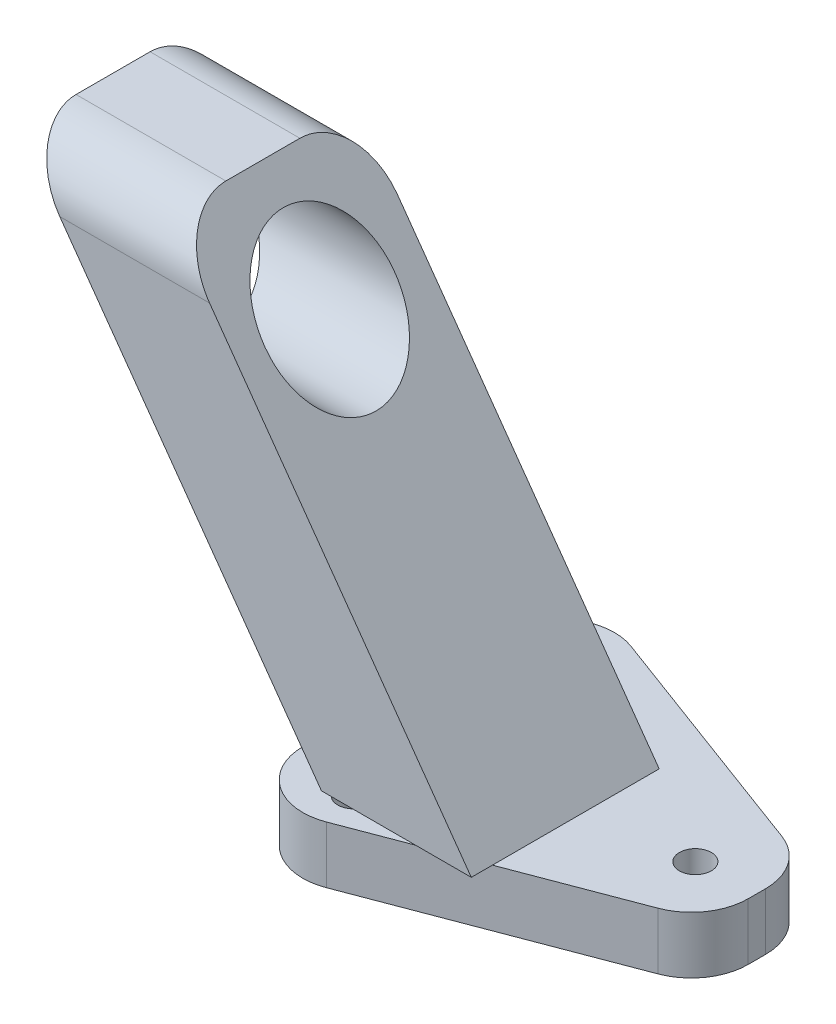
SolidWorks part; units mm, degrees
ref_plane "前视基准面" through (0, 0, 0) normal (0, 0, 1) x (1, 0, 0)
ref_plane "上视基准面" through (0, 0, 0) normal (0, 1, 0) x (1, 0, 0)
ref_plane "右视基准面" through (0, 0, 0) normal (1, 0, 0) x (0, 0, -1)
sketch "草图1" plane through (0, 0, 0) normal (0, 1, 0) x (1, 0, 0)
  line L0 (-6.9131, 24.5945) -> (14.2, 16.7547)
  line L2 (-13.6536, 19.9072) -> (-13.6536, 2.5307)
  line L5 (17.4595, 12.0675) -> (17.4595, 10.534)
  line L6 (14.2318, 5.8587) -> (-6.8813, -2.1447)
  circle A0 centre (-7.68, 21.0315) radius 1.3961
  circle A1 centre (-7.68, 1.0315) radius 1.3964
  circle A2 centre (12.32, 11.0315) radius 1.4013
  arc A3 (-13.6536, 19.9072) -> (-6.9131, 24.5945) centre (-8.6536, 19.9072) cw
  arc A4 (17.4595, 10.534) -> (14.2318, 5.8587) centre (12.4595, 10.534) cw
  arc A5 (14.2, 16.7547) -> (17.4595, 12.0675) centre (12.4595, 12.0675) cw
  arc A6 (-6.8813, -2.1447) -> (-13.6536, 2.5307) centre (-8.6536, 2.5307) cw
  dimension "D1" = 5
  dimension "D2" = 5
extrude "凸台-拉伸1" add sketch "草图1" along normal blind 5
sketch "草图2" plane through (0, 0, 0) normal (0, 0, 1) x (1, 0, 0)
  line L0 (3.6753, 5) -> (-22.9469, 42.2804)
  line L1 (-6.8813, 5) -> (14.2318, 5) construction
  line L2 (-22.9469, 42.2804) -> (-36.1015, 42.2804)
  line L3 (-36.1015, 42.2804) -> (-9.4793, 5)
  line L4 (-6.8813, 5) -> (-13.6536, 5) construction
  line L5 (-9.4793, 5) -> (3.6753, 5)
extrude "凸台-拉伸2" add sketch "草图2" against normal blind 16.5
sketch "草图3" plane through (0, 0, 0) normal (0, 0, 1) x (1, 0, 0)
  line L0 (-36.1015, 42.2804) -> (-22.9469, 42.2804)
  line L1 (-22.9469, 42.2804) -> (3.6753, 5)
  line L2 (3.6753, 5) -> (-9.4793, 5)
  line L3 (-9.4793, 5) -> (-36.1015, 42.2804)
sketch "草图4" plane through (130.3294, 15.9383, 2.8459) normal (1, 0, 0) x (0, -1, 0)
  circle A0 centre (-17.8903, 11) radius 5.7
extrude "切除-拉伸2" cut sketch "草图4" against normal blind 179
sketch "草图5" plane through (0, 42.2804, 0) normal (0, 1, 0) x (1, 0, 0)
  line L1 (-38.8482, 19.6052) -> (-19.2437, 19.6052)
  line L2 (-38.8482, 19.6052) -> (-38.8482, -2.4539)
  line L3 (-38.8482, -2.4539) -> (-19.2437, -2.4539)
  line L4 (-19.2437, 19.6052) -> (-19.2437, -2.4539)
extrude "切除-拉伸3" cut sketch "草图5" against normal blind 0.1
fillet "圆角2" radius 5 2 edges at (-29.4528, 42.1804, 0) (-29.4528, 42.1804, -16.5)
